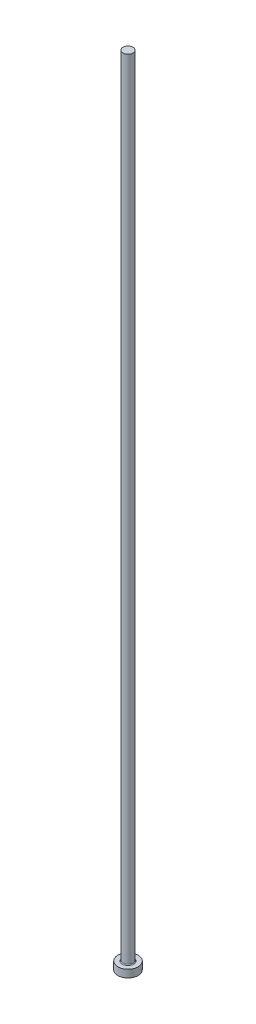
SolidWorks part; units mm, degrees
ref_plane "Plano frontal" through (0, 0, 0) normal (0, 0, 1) x (1, 0, 0)
ref_plane "Plano superior" through (0, 0, 0) normal (0, 1, 0) x (1, 0, 0)
ref_plane "Plano direito" through (0, 0, 0) normal (1, 0, 0) x (0, 0, -1)
sketch "Esboço1" plane through (0, 0, 0) normal (0, 0, 1) x (1, 0, 0)
  line L0 (0, 0) -> (4, 0)
  line L1 (4, 0) -> (4, 3)
  line L2 (4, 3) -> (2.3, 3)
  line L3 (2, 3.3) -> (2, 315)
  line L4 (2, 315) -> (0, 315)
  line L5 (0, 315) -> (0, 0) construction
  line L6 (0, 0) -> (0, 315)
  arc A0 (2.3, 3) -> (2, 3.3) centre (2.3, 3.3) cw
  dimension "D3" = 0.3
  dimension "D1" = 8
  dimension "D2" = 4
  dimension "D4" = 3
  dimension "D5" = 315
revolve "Revolução1" add sketch "Esboço1" angle 360 about L5
sketch "Esboço2"
  dimension "D1" = 0.45
  dimension "D2" = 0.7
  dimension "D3" = 0.3
  dimension "D4" = 2.15
wrap "Envolver1" sketch "Esboço2" wrap type deboss source sketch "Esboço2" thickness 0.1 parameters "D1"=0.1
